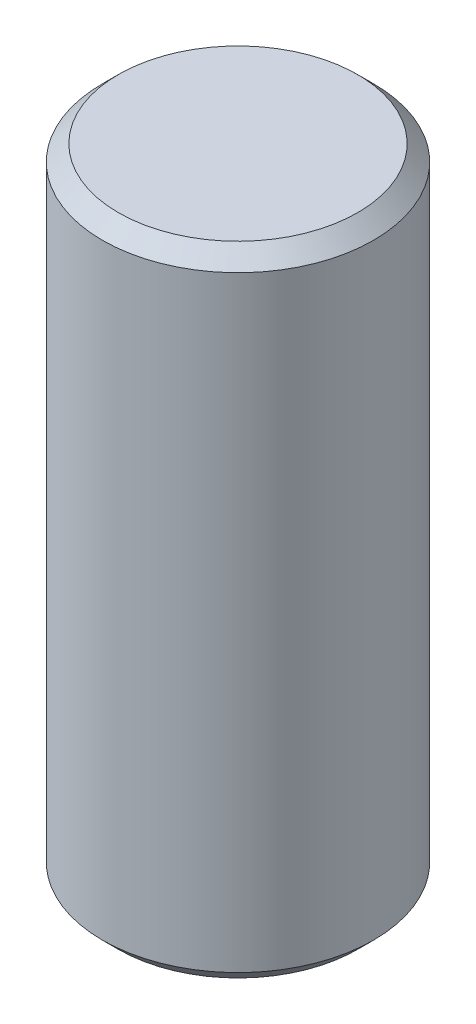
SolidWorks part; units mm, degrees
ref_plane "Front Plane" through (0, 0, 0) normal (0, 0, 1) x (1, 0, 0)
ref_plane "Top Plane" through (0, 0, 0) normal (0, 1, 0) x (1, 0, 0)
ref_plane "Right Plane" through (0, 0, 0) normal (1, 0, 0) x (0, 0, -1)
sketch "Sketch1" plane through (0, 0, 0) normal (0, 1, 0) x (1, 0, 0)
  circle A0 centre (0, 0) radius 2.55
  dimension "D1" = 5.1
extrude "Boss-Extrude1" add sketch "Sketch1" along normal mid plane 12
chamfer "Chamfer1" distance 0.3 angle 45 2 edges at (0, -6, 2.55) (0, 6, 2.55)
